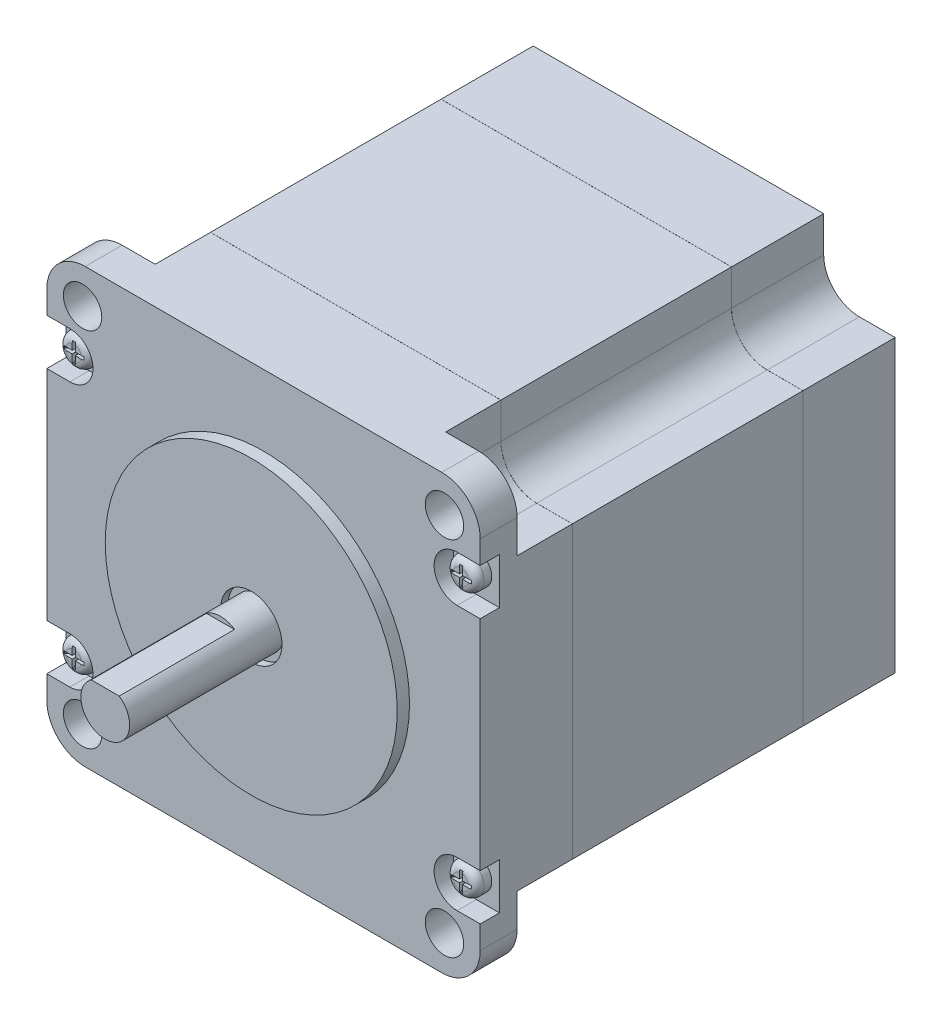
SolidWorks part; units mm, degrees
ref_plane "Front Plane" through (0, 0, 0) normal (0, 0, 1) x (1, 0, 0)
ref_plane "Top Plane" through (0, 0, 0) normal (0, 1, 0) x (1, 0, 0)
ref_plane "Right Plane" through (0, 0, 0) normal (1, 0, 0) x (0, 0, -1)
sketch "Sketch1" plane through (0, 0, 0) normal (0, 0, 1) x (1, 0, 0)
  line L1 (-28.2, -28.2) -> (28.2, -28.2)
  line L2 (-28.2, -28.2) -> (-28.2, 28.2)
  line L3 (-28.2, 28.2) -> (28.2, 28.2)
  line L4 (28.2, -28.2) -> (28.2, 28.2)
  line L5 (-28.2, -28.2) -> (28.2, 28.2) construction
  line L6 (-28.2, 28.2) -> (28.2, -28.2) construction
  point P0 (0, 0)
  dimension "D1" = 56.4
  dimension "D2" = 56.4
extrude "Boss-Extrude1" add sketch "Sketch1" against normal blind 54
sketch "Sketch2" plane through (0, 0, 0) normal (0, 0, 1) x (1, 0, 0)
  circle A0 centre (0, 0) radius 19
  dimension "D1" = 38
extrude "Boss-Extrude2" add sketch "Sketch2" along normal blind 1.6
sketch "Sketch3" plane through (0, 0, 0) normal (0, 0, 1) x (1, 0, 0)
  line L0 (-23.55, 23.55) -> (23.55, 23.55) construction
  line L1 (23.55, 23.55) -> (23.55, -23.55) construction
  line L2 (23.55, -23.55) -> (-23.55, -23.55) construction
  line L3 (-23.55, -23.55) -> (-23.55, 23.55) construction
  line L4 (23.55, 23.55) -> (-23.55, -23.55) construction
  circle A0 centre (-23.55, 23.55) radius 2.5
  circle A1 centre (23.55, 23.55) radius 2.5
  circle A2 centre (23.55, -23.55) radius 2.5
  circle A3 centre (-23.55, -23.55) radius 2.5
  dimension "D1" = 5
  dimension "D2" = 47.1
  dimension "D3" = 47.1
extrude "Cut-Extrude1" cut sketch "Sketch3" against normal blind 10
sketch "Sketch6" plane through (0, 0, -54) normal (0, 0, -1) x (-1, 0, 0)
  line L0 (-18.9, 23.55) -> (-18.9, 28.2)
  line L1 (-28.2, 28.2) -> (28.2, 28.2) construction
  line L2 (-23.55, 18.9) -> (-28.2, 18.9)
  line L3 (-28.2, -28.2) -> (-28.2, 28.2) construction
  line L4 (-28.2, 0) -> (28.2, 0) construction
  line L5 (28.2, 28.2) -> (28.2, -28.2) construction
  line L6 (0, 28.2) -> (0, -28.2) construction
  line L7 (28.2, -28.2) -> (-28.2, -28.2) construction
  line L8 (-18.9, 28.2) -> (-28.2, 28.2)
  line L9 (-28.2, 28.2) -> (-28.2, 18.9)
  line L10 (28.2, 28.2) -> (28.2, 18.9)
  line L11 (18.9, 28.2) -> (28.2, 28.2)
  line L12 (23.55, 18.9) -> (28.2, 18.9)
  line L13 (18.9, 23.55) -> (18.9, 28.2)
  line L14 (-28.2, -28.2) -> (-28.2, -18.9)
  line L15 (-18.9, -28.2) -> (-28.2, -28.2)
  line L16 (-23.55, -18.9) -> (-28.2, -18.9)
  line L17 (-18.9, -23.55) -> (-18.9, -28.2)
  line L18 (18.9, -23.55) -> (18.9, -28.2)
  line L19 (23.55, -18.9) -> (28.2, -18.9)
  line L20 (18.9, -28.2) -> (28.2, -28.2)
  line L21 (28.2, -28.2) -> (28.2, -18.9)
  arc A4 (23.55, 18.9) -> (18.9, 23.55) centre (23.55, 23.55) cw
  arc A5 (-23.55, -18.9) -> (-18.9, -23.55) centre (-23.55, -23.55) cw
  arc A6 (-23.55, 18.9) -> (-18.9, 23.55) centre (-23.55, 23.55) ccw
  arc A7 (23.55, -18.9) -> (18.9, -23.55) centre (23.55, -23.55) ccw
extrude "Cut-Extrude2" cut sketch "Sketch6" against normal blind 49.2
fillet "Fillet1" radius 5 4 edges at (28.2, -28.2, -2.4) (-28.2, -28.2, -2.4) (-28.2, 28.2, -2.4) (28.2, 28.2, -2.4)
sketch "Sketch7" plane through (-28.2, 0, 0) normal (-1, 0, 0) x (0, 0, 1)
  line L0 (-4.8, 28.2) -> (-54, 28.2) construction
  line L1 (-12, -28.2) -> (-42, -28.2)
  line L2 (-12, -28.2) -> (-12, 28.2)
  line L3 (-12, 28.2) -> (-42, 28.2)
  line L4 (-42, -28.2) -> (-42, 28.2)
  line L5 (-12, -28.2) -> (-42, 28.2) construction
  line L6 (-12, 28.2) -> (-42, -28.2) construction
  line L7 (-27, -28.2) -> (-27, 28.2) construction
  line L9 (-54, 0) -> (0, 0) construction
  line L10 (-54, 18.9) -> (-54, -18.9) construction
  line L11 (-42.01, -28.21) -> (-42.01, 28.21)
  line L12 (-11.99, 28.21) -> (-42.01, 28.21)
  line L13 (-11.99, -28.21) -> (-11.99, 28.21)
  line L14 (-11.99, -28.21) -> (-42.01, -28.21)
  point P0 (-27, 0)
  dimension "D1" = 30
  dimension "D2" = 0.01
extrude "Cut-Extrude3" cut sketch "Sketch7" against normal through all
sketch "Sketch8" plane through (0, 0, -54) normal (0, 0, -1) x (-1, 0, 0)
  circle A0 centre (0, 0) radius 6
  dimension "D1" = 12
extrude "Cut-Extrude4" cut sketch "Sketch8" against normal blind 3
sketch "Sketch9" plane through (0, 0, -51) normal (0, 0, -1) x (-1, 0, 0)
  circle A0 centre (0, 0) radius 3
  dimension "D1" = 6
extrude "Boss-Extrude3" add sketch "Sketch9" along normal blind 1.5 separate body
chamfer "Chamfer1" distance 0.5 angle 45 1 edges at (-3, 0, -52.5)
sketch "Sketch10" plane through (0, 0, 1.6) normal (0, 0, 1) x (1, 0, 0)
  circle A0 centre (0, 0) radius 4
  dimension "D1" = 8
extrude "Cut-Extrude5" cut sketch "Sketch10" against normal blind 1
sketch "Sketch11" plane through (0, 0, 0.6) normal (0, 0, 1) x (1, 0, 0)
  circle A0 centre (0, 0) radius 3.175
  dimension "D1" = 6.35
extrude "Boss-Extrude4" add sketch "Sketch11" along normal blind 20 separate body
sketch "Sketch12" plane through (0, 0, 20.6) normal (0, 0, 1) x (1, 0, 0)
  line L0 (-1.8223, 2.6) -> (1.8223, 2.6)
  arc A0 (1.8223, 2.6) -> (-1.8223, 2.6) centre (0, 0) ccw
  dimension "D1" = 2.6
extrude "Cut-Extrude6" cut sketch "Sketch12" against normal blind 15
sketch "Sketch13" plane through (0, 0, 0) normal (0, 0, 1) x (1, 0, 0)
  line L0 (-28.2, 23.2) -> (-28.2, -23.2) construction
  line L1 (23.2, 28.2) -> (-23.2, 28.2) construction
  line L2 (-25.2, 20.2) -> (-28.2, 20.2)
  line L3 (-28.2, 20.2) -> (-28.2, 14.2)
  line L4 (-28.2, 14.2) -> (-25.2, 14.2)
  line L5 (0, 28.2) -> (0, 21.4759) construction
  line L6 (-28.2, 0) -> (-22.9335, 0) construction
  line L7 (28.2, 14.2) -> (25.2, 14.2)
  line L8 (28.2, 20.2) -> (28.2, 14.2)
  line L9 (25.2, 20.2) -> (28.2, 20.2)
  line L10 (25.2, -20.2) -> (28.2, -20.2)
  line L11 (28.2, -20.2) -> (28.2, -14.2)
  line L12 (28.2, -14.2) -> (25.2, -14.2)
  line L13 (-28.2, -14.2) -> (-25.2, -14.2)
  line L14 (-28.2, -20.2) -> (-28.2, -14.2)
  line L15 (-25.2, -20.2) -> (-28.2, -20.2)
  arc A0 (-25.2, 14.2) -> (-25.2, 20.2) centre (-25.2, 17.2) ccw
  arc A1 (25.2, 14.2) -> (25.2, 20.2) centre (25.2, 17.2) cw
  arc A2 (25.2, -14.2) -> (25.2, -20.2) centre (25.2, -17.2) ccw
  arc A3 (-25.2, -14.2) -> (-25.2, -20.2) centre (-25.2, -17.2) cw
  dimension "D1" = 6
  dimension "D2" = 3
  dimension "D3" = 11
extrude "Cut-Extrude7" cut sketch "Sketch13" against normal blind 2.5
sketch "Sketch14" plane through (0, 0, -2.5) normal (0, 0, 1) x (1, 0, 0)
  circle A0 centre (-25.2, 17.2) radius 2
  circle A1 centre (25.2, 17.2) radius 2
  circle A2 centre (25.2, -17.2) radius 2
  circle A3 centre (-25.2, -17.2) radius 2
  dimension "D1" = 4
extrude "Boss-Extrude5" add sketch "Sketch14" along normal blind 2 separate body
fillet "Fillet2" radius 1 1 edges at (-23.2, 17.2, -0.5)
fillet "Fillet3" radius 1 1 edges at (-23.2, -17.2, -0.5)
fillet "Fillet4" radius 1 1 edges at (27.2, -17.2, -0.5)
fillet "Fillet5" radius 1 1 edges at (27.2, 17.2, -0.5)
sketch "Sketch15" plane through (0, 0, -0.5) normal (0, 0, 1) x (1, 0, 0)
  line L0 (-25.399, 17.4039) -> (-25.399, 18.476)
  line L1 (-25.399, 15.924) -> (-25.001, 15.924)
  line L2 (-25.399, 15.924) -> (-25.399, 16.9961)
  line L3 (-25.399, 18.476) -> (-25.001, 18.476)
  line L4 (-25.001, 15.924) -> (-25.001, 16.9961)
  line L5 (-25.399, 15.924) -> (-25.001, 18.476) construction
  line L6 (-25.399, 18.476) -> (-25.001, 15.924) construction
  line L7 (-26.5074, 16.9961) -> (-25.399, 16.9961)
  line L8 (-26.5074, 16.9961) -> (-26.5074, 17.4039)
  line L9 (-26.5074, 17.4039) -> (-25.399, 17.4039)
  line L10 (-23.8926, 16.9961) -> (-23.8926, 17.4039)
  line L11 (-26.5074, 16.9961) -> (-23.8926, 17.4039) construction
  line L12 (-26.5074, 17.4039) -> (-23.8926, 16.9961) construction
  line L13 (-25.001, 16.9961) -> (-23.8926, 16.9961)
  line L14 (-25.001, 17.4039) -> (-23.8926, 17.4039)
  line L15 (-25.001, 17.4039) -> (-25.001, 18.476)
  line L16 (0, 28.2) -> (0, 21.2733) construction
  line L17 (23.2, 28.2) -> (-23.2, 28.2) construction
  line L18 (-28.2, 0) -> (-21.4297, 0) construction
  line L19 (-28.2, 14.2) -> (-28.2, -14.2) construction
  line L20 (26.5074, 17.4039) -> (23.8926, 16.9961) construction
  line L21 (26.5074, 16.9961) -> (23.8926, 17.4039) construction
  line L22 (25.399, 18.476) -> (25.001, 15.924) construction
  line L23 (25.399, 15.924) -> (25.001, 18.476) construction
  line L24 (25.001, 17.4039) -> (25.001, 18.476)
  line L25 (25.001, 17.4039) -> (23.8926, 17.4039)
  line L26 (25.001, 16.9961) -> (23.8926, 16.9961)
  line L27 (23.8926, 16.9961) -> (23.8926, 17.4039)
  line L28 (26.5074, 17.4039) -> (25.399, 17.4039)
  line L29 (26.5074, 16.9961) -> (26.5074, 17.4039)
  line L30 (26.5074, 16.9961) -> (25.399, 16.9961)
  line L31 (25.001, 15.924) -> (25.001, 16.9961)
  line L32 (25.399, 18.476) -> (25.001, 18.476)
  line L33 (25.399, 15.924) -> (25.399, 16.9961)
  line L34 (25.399, 15.924) -> (25.001, 15.924)
  line L35 (25.399, 17.4039) -> (25.399, 18.476)
  line L36 (25.399, -15.924) -> (25.001, -18.476) construction
  line L37 (25.399, -18.476) -> (25.001, -15.924) construction
  line L38 (26.5074, -16.9961) -> (23.8926, -17.4039) construction
  line L39 (26.5074, -17.4039) -> (23.8926, -16.9961) construction
  line L40 (25.399, -17.4039) -> (25.399, -18.476)
  line L41 (25.399, -15.924) -> (25.001, -15.924)
  line L42 (25.399, -15.924) -> (25.399, -16.9961)
  line L43 (25.399, -18.476) -> (25.001, -18.476)
  line L44 (25.001, -15.924) -> (25.001, -16.9961)
  line L45 (26.5074, -16.9961) -> (25.399, -16.9961)
  line L46 (26.5074, -16.9961) -> (26.5074, -17.4039)
  line L47 (26.5074, -17.4039) -> (25.399, -17.4039)
  line L48 (23.8926, -16.9961) -> (23.8926, -17.4039)
  line L49 (25.001, -16.9961) -> (23.8926, -16.9961)
  line L50 (25.001, -17.4039) -> (23.8926, -17.4039)
  line L51 (25.001, -17.4039) -> (25.001, -18.476)
  line L52 (-26.5074, -17.4039) -> (-23.8926, -16.9961) construction
  line L53 (-26.5074, -16.9961) -> (-23.8926, -17.4039) construction
  line L54 (-25.399, -18.476) -> (-25.001, -15.924) construction
  line L55 (-25.399, -15.924) -> (-25.001, -18.476) construction
  line L56 (-25.001, -17.4039) -> (-25.001, -18.476)
  line L57 (-25.001, -17.4039) -> (-23.8926, -17.4039)
  line L58 (-25.001, -16.9961) -> (-23.8926, -16.9961)
  line L59 (-23.8926, -16.9961) -> (-23.8926, -17.4039)
  line L60 (-26.5074, -17.4039) -> (-25.399, -17.4039)
  line L61 (-26.5074, -16.9961) -> (-26.5074, -17.4039)
  line L62 (-26.5074, -16.9961) -> (-25.399, -16.9961)
  line L63 (-25.001, -15.924) -> (-25.001, -16.9961)
  line L64 (-25.399, -18.476) -> (-25.001, -18.476)
  line L65 (-25.399, -15.924) -> (-25.399, -16.9961)
  line L66 (-25.399, -15.924) -> (-25.001, -15.924)
  line L67 (-25.399, -17.4039) -> (-25.399, -18.476)
  point P0 (-25.2, 17.2)
  point P6 (-25.2, 17.2)
  point P36 (25.2, 17.2)
  point P49 (25.2, -17.2)
  point P62 (-25.2, -17.2)
extrude "Cut-Extrude8" cut sketch "Sketch15" against normal blind 1.2
chamfer "Chamfer2" distance 1 angle 45 4 edges at (-25.2, 15.924, -1.7) (-23.8926, 17.2, -1.7) (-26.5074, 17.2, -1.7) (-25.2, 18.476, -1.7)
chamfer "Chamfer3" distance 1 angle 45 4 edges at (26.5074, 17.2, -1.7) (25.2, 18.476, -1.7) (25.2, 15.924, -1.7) (23.8926, 17.2, -1.7)
chamfer "Chamfer4" distance 1 angle 45 4 edges at (25.2, -15.924, -1.7) (25.2, -18.476, -1.7) (23.8926, -17.2, -1.7) (26.5074, -17.2, -1.7)
chamfer "Chamfer5" distance 1 angle 45 4 edges at (-23.8926, -17.2, -1.7) (-26.5074, -17.2, -1.7) (-25.2, -18.476, -1.7) (-25.2, -15.924, -1.7)
